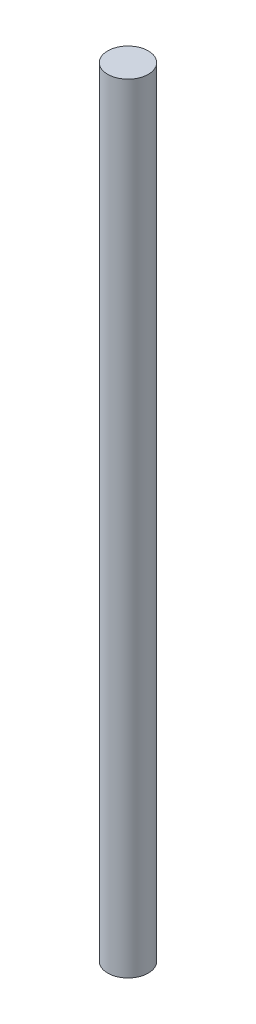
SolidWorks part; units mm, degrees
ref_plane "Front Plane" through (0, 0, 0) normal (0, 0, 1) x (1, 0, 0)
ref_plane "Top Plane" through (0, 0, 0) normal (0, 1, 0) x (1, 0, 0)
ref_plane "Right Plane" through (0, 0, 0) normal (1, 0, 0) x (0, 0, -1)
sketch "Sketch1" plane through (0, 0, 0) normal (0, 1, 0) x (1, 0, 0)
  circle A0 centre (0, 0) radius 2.6095
  dimension "D1" = 5.219
extrude "Boss-Extrude1" add sketch "Sketch1" along normal blind 100
